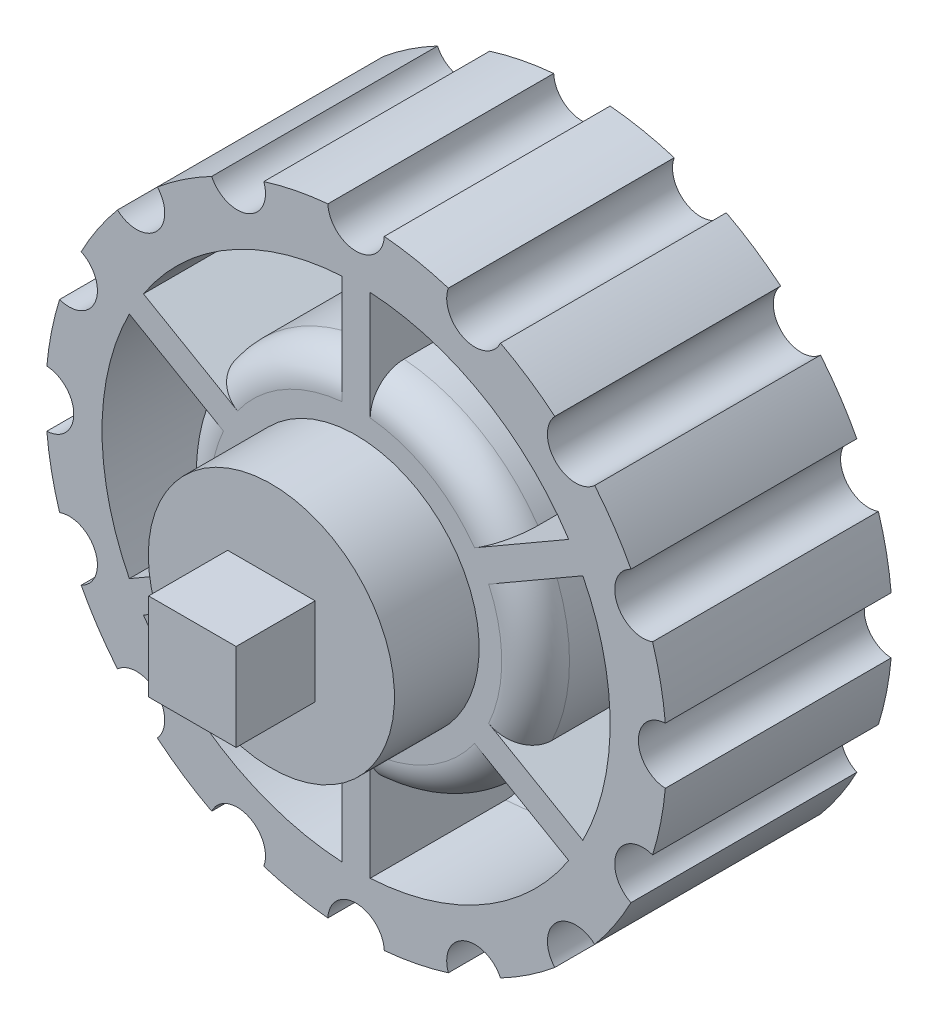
SolidWorks part; units mm, degrees
ref_plane "Front Plane" through (0, 0, 0) normal (0, 0, 1) x (1, 0, 0)
ref_plane "Top Plane" through (0, 0, 0) normal (0, 1, 0) x (1, 0, 0)
ref_plane "Right Plane" through (0, 0, 0) normal (1, 0, 0) x (0, 0, -1)
sketch "Sketch1" plane through (0, 0, 0) normal (0, 0, 1) x (1, 0, 0)
  line L1 (3.875, -3.875) -> (-3.875, -3.875)
  line L2 (3.875, -3.875) -> (3.875, 3.875)
  line L3 (3.875, 3.875) -> (-3.875, 3.875)
  line L4 (-3.875, -3.875) -> (-3.875, 3.875)
  point P4 (-3.875, 0)
  point P6 (0, 3.875)
  dimension "D1" = 7.75
  dimension "D2" = 7.75
extrude "Boss-Extrude1" add sketch "Sketch1" along normal blind 7 contours L4 L3 L2 L1
sketch "Sketch3" plane through (0, 0, 0) normal (0, 0, -1) x (-1, 0, 0)
  circle A0 centre (0, 0) radius 10.9
  dimension "D1" = 21.8
extrude "Boss-Extrude2" add sketch "Sketch3" along normal blind 7.5
sketch "Sketch4" plane through (0, 0, -7.5) normal (0, 0, -1) x (-1, 0, 0)
  circle A0 centre (0, 0) radius 27.5
  dimension "D1" = 55
extrude "Boss-Extrude3" add sketch "Sketch4" along normal blind 20
sketch "Sketch5" plane through (0, 0, -27.5) normal (0, 0, -1) x (-1, 0, 0)
  circle A0 centre (0, 27.5) radius 2.5
  circle A1 centre (0, 0) radius 27.5 construction
  dimension "D1" = 5
extrude "Cut-Extrude1" cut sketch "Sketch5" against normal up to surface (20 mm away)
pattern_circular "CirPattern1" count 16 over 360 about axis through (0, 0, 0) along (0, 0, 1) of "Cut-Extrude1"
sketch "Sketch6" plane through (0, 0, -27.5) normal (0, 0, -1) x (-1, 0, 0)
  line L0 (0, 0) -> (0, 14)
  line L1 (0, 0) -> (0, -14)
  line L2 (-1.9447, 10.9657) -> (0, 13.25)
  line L3 (0, 13.25) -> (-2.2843, 15.1947)
  line L4 (-2.2843, 15.1947) -> (-1.9447, 10.9657)
  line L5 (0, 0) -> (-7, -12.1244)
  arc A0 (0, 12.5) -> (0, -12.5) centre (0, 0) ccw
  arc A1 (0, 14) -> (0, -14) centre (0, 0) ccw
  arc A2 (0, 13.25) -> (0, -13.25) centre (0, 0) ccw
  point P15 (-2.1145, 13.0802)
  dimension "D1" = 1.5
  dimension "D2" = 25
  dimension "D3" = 0.75
  dimension "D4" = 3
  dimension "D5" = 30
extrude "Cut-Extrude3" cut sketch "Sketch6" against normal blind 0.2 contours L4 A2 L5 A0 | A2 L4 A1 L5 | L2 A2 L4 A0 | L2 A0 L4 | A2 L3 A1 L4 | A1 L3 L4
pattern_circular "CirPattern2" count 2 over 360 about axis through (0, 0, 0) along (0, 0, 1) of "Cut-Extrude3"
sketch "Sketch7" plane through (0, 0, -7.5) normal (0, 0, 1) x (1, 0, 0)
  circle A0 centre (0, 0) radius 22.5
  circle A1 centre (0, 0) radius 15.9
  circle A2 centre (0, 0) radius 10.9 construction
  arc A3 (-21.131, 17.5991) -> (-24.346, 12.7876) centre (0, 0) ccw construction
  dimension "D1" = 5
  dimension "D2" = 5
extrude "Cut-Extrude4" cut sketch "Sketch7" against normal offset from surface (15 mm away) 5
fillet "Fillet1" radius 3 3 edges at (15.9, 0, -7.5) (-15.9, 0, -22.5) (-22.5, 0, -22.5)
sketch "Sketch8" plane through (0, 0, -7.5) normal (0, 0, 1) x (1, 0, 0)
  line L0 (3.875, 3.875) -> (-3.875, 3.875) construction
  line L1 (-1.25, 3.875) -> (1.25, 3.875)
  line L2 (-1.25, 3.875) -> (-1.25, 22.5)
  line L3 (-1.25, 22.5) -> (1.25, 22.5)
  line L4 (1.25, 3.875) -> (1.25, 22.5)
  circle A0 centre (0, 0) radius 22.5 construction
  point P6 (0, 22.5)
  dimension "D1" = 2.5
extrude "Boss-Extrude4" add sketch "Sketch8" against normal up to surface (15 mm away)
pattern_circular "CirPattern3" count 6 over 360 about axis through (0, 0, 0) along (0, 0, 1) of "Boss-Extrude4"
